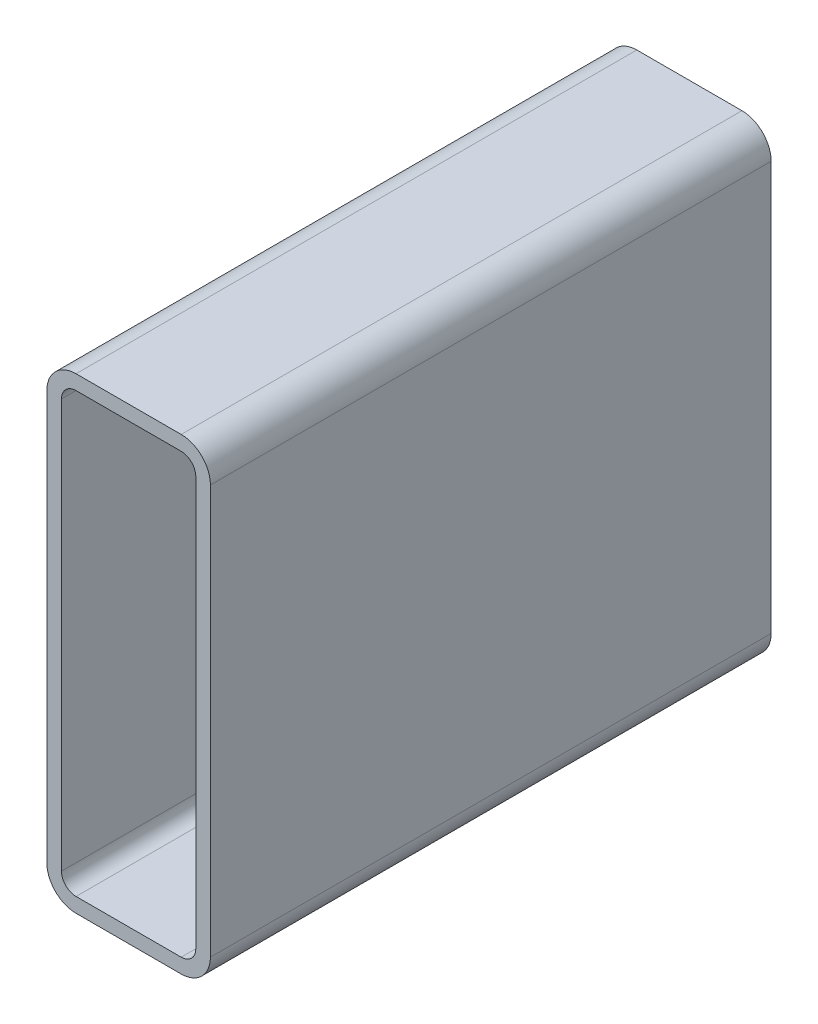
SolidWorks part; units mm, degrees
ref_plane "Front Plane" through (0, 0, 0) normal (0, 0, 1) x (1, 0, 0)
ref_plane "Top Plane" through (0, 0, 0) normal (0, 1, 0) x (1, 0, 0)
ref_plane "Right Plane" through (0, 0, 0) normal (1, 0, 0) x (0, 0, -1)
sketch "Sketch1" plane through (0, 0, 0) normal (0, 0, 1) x (1, 0, 0)
sketch_block_instance "HSS10x3.5x0.3125-1"
sketch_block "HSS10x3.5x0.3125"
extrude "Boss-Extrude1" add sketch "Sketch1" along normal blind 304.8
